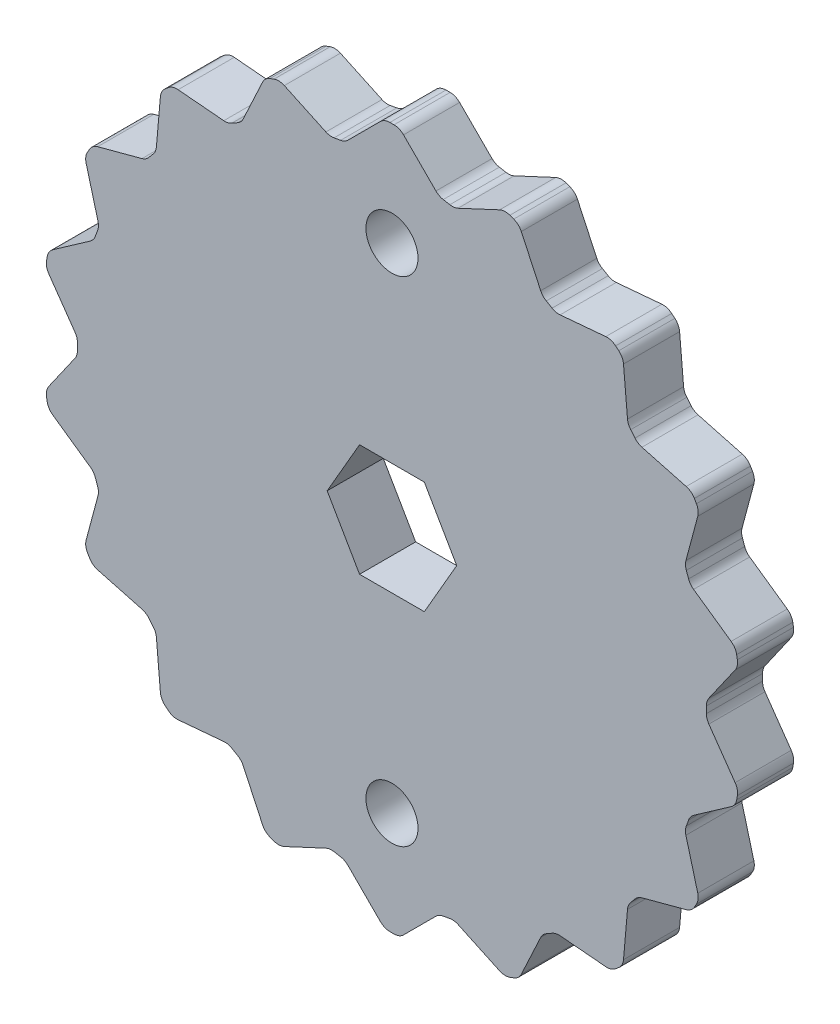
SolidWorks part; units mm, degrees
ref_plane "Front Plane" through (0, 0, 0) normal (0, 0, 1) x (1, 0, 0)
ref_plane "Top Plane" through (0, 0, 0) normal (0, 1, 0) x (1, 0, 0)
ref_plane "Right Plane" through (0, 0, 0) normal (1, 0, 0) x (0, 0, -1)
sketch "Sketch2" plane through (0, 0, 0) normal (0, 0, 1) x (1, 0, 0)
  line L0 (0, 0) -> (0, 44.1565) construction
  line L1 (0, 0) -> (-7.6914, 43.6198) construction
  line L2 (0.4318, 19.8293) -> (-0.4318, 19.8293)
  line L3 (-0.4318, 19.8293) -> (-2.6644, 17.5968)
  line L4 (0.4318, 19.8293) -> (2.6644, 17.5968)
  circle A0 centre (0, 0) radius 17.7973 construction
  arc A1 (-2.6644, 17.5968) -> (-3.0905, 17.5269) centre (0, 0) ccw
  arc A2 (2.6644, 17.5968) -> (3.0905, 17.5269) centre (0, 0) cw
  arc A3 (-3.0905, 17.5269) -> (3.0905, 17.5269) centre (0, 17.7973) ccw
  point P3 (0, 17.7973)
  point P11 (0, 19.8293)
  dimension "D1" = 10
  dimension "D5" = 0.4318
  dimension "D2" = 0.4318
  dimension "D3" = 2.032
  dimension "D4" = 45
extrude "Boss-Extrude1" add sketch "Sketch2" along normal blind 3.175
sketch "Sketch3" plane through (0, 0, 0) normal (0, 0, 1) x (1, 0, 0)
  circle A0 centre (0, 0) radius 17.7973
  arc A1 (-2.6644, 17.5968) -> (-3.0905, 17.5269) centre (0, 0) ccw construction
extrude "Boss-Extrude2" add sketch "Sketch3" along normal blind 3.175
fillet "Fillet1" radius 0.762 4 edges at (2.6644, 17.5968, 1.5875) (0.4318, 19.8293, 1.5875) (-0.4318, 19.8293, 1.5875) (-2.6644, 17.5968, 1.5875)
pattern_circular "CirPattern1" count 18 over 360 about axis through (0, 0, 0) along (0, 0, 1) of "Fillet1", "Boss-Extrude1"
sketch "Sketch4" plane through (0, 0, 3.175) normal (0, 0, 1) x (1, 0, 0)
  line L1 (1.8331, -3.175) -> (3.6662, 0)
  line L2 (3.6662, 0) -> (1.8331, 3.175)
  line L3 (1.8331, 3.175) -> (-1.8331, 3.175)
  line L4 (-1.8331, 3.175) -> (-3.6662, 0)
  line L5 (-3.6662, 0) -> (-1.8331, -3.175)
  line L6 (-1.8331, -3.175) -> (1.8331, -3.175)
  circle A0 centre (0, 0) radius 3.175 construction
  dimension "D1" = 6.35
extrude "Cut-Extrude1" cut sketch "Sketch4" against normal through all
hole_wizard "#4 Clearance Hole1" positions "Sketch6" profile "Sketch5" hole size "#4" standard "ANSI Inch"
sketch "Sketch6" plane through (0, 0, 3.175) normal (0, 0, 1) x (1, 0, 0)
  point P0 (0, 13.97)
  point P2 (0, -13.97)
  dimension "D1" = 13.97
  dimension "D2" = 13.97
sketch "Sketch5" plane through (0, 13.97, 3.175) normal (1, 0, 0) x (0, -1, 0)
  line L0 (0, 0) -> (0, 3.175)
  line L1 (0, 3.175) -> (1.4732, 3.175)
  line L2 (1.4732, 3.175) -> (1.4732, 0)
  line L5 (1.4732, 0) -> (0, 0)
  line L11 (0, -6.35) -> (0, 107.95) construction
  dimension "Thru Hole Dia." = 2.9464
  dimension "Thru Hole Depth" = 3.175
